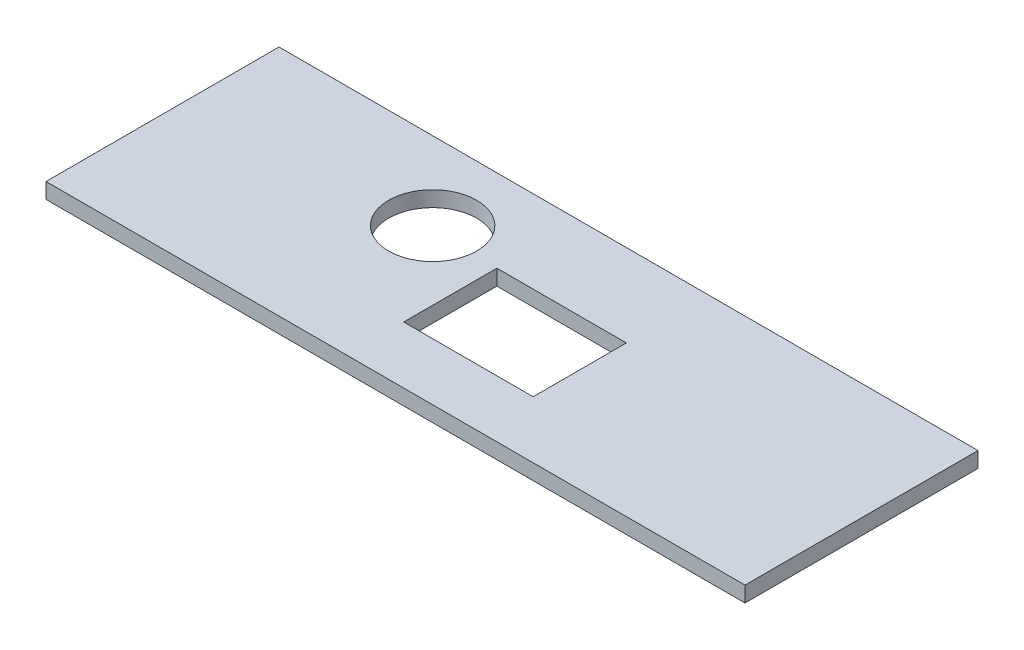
SolidWorks part; units mm, degrees
ref_plane "Front Plane" through (0, 0, 0) normal (0, 0, 1) x (1, 0, 0)
ref_plane "Top Plane" through (0, 0, 0) normal (0, 1, 0) x (1, 0, 0)
ref_plane "Right Plane" through (0, 0, 0) normal (1, 0, 0) x (0, 0, -1)
sketch "Sketch1" plane through (0, 0, 0) normal (0, 1, 0) x (1, 0, 0)
  line L1 (-67.5, -22.5) -> (67.5, -22.5)
  line L2 (-67.5, -22.5) -> (-67.5, 22.5)
  line L3 (-67.5, 22.5) -> (67.5, 22.5)
  line L4 (67.5, -22.5) -> (67.5, 22.5)
  line L5 (-67.5, -22.5) -> (67.5, 22.5) construction
  line L6 (-67.5, 22.5) -> (67.5, -22.5) construction
  point P0 (0, 0)
  dimension "D1" = 135
  dimension "D2" = 45
extrude "Boss-Extrude1" add sketch "Sketch1" along normal blind 3
sketch "Sketch2" plane through (0, 0, 0) normal (0, -1, 0) x (1, 0, 0)
  line L0 (67.5, -22.5) -> (-67.5, -22.5) construction
  line L1 (-9.4584, 11.4584) -> (15.5416, 11.4584)
  line L2 (-9.4584, 11.4584) -> (-9.4584, -6.5416)
  line L3 (-9.4584, -6.5416) -> (15.5416, -6.5416)
  line L4 (15.5416, 11.4584) -> (15.5416, -6.5416)
  line L5 (-9.4584, 11.4584) -> (15.5416, -6.5416) construction
  line L6 (-9.4584, -6.5416) -> (15.5416, 11.4584) construction
  line L7 (67.5, 22.5) -> (67.5, -22.5) construction
  point P0 (3.0416, 2.4584)
  dimension "D1" = 25
  dimension "D2" = 18
  dimension "D3" = 24.9584
  dimension "D4" = 64.4584
extrude "Cut-Extrude1" cut sketch "Sketch2" against normal up to next
sketch "Sketch3" plane through (0, 0, 0) normal (0, -1, 0) x (-1, 0, 0)
  line L0 (-67.5, 22.5) -> (67.5, 22.5) construction
  line L1 (67.5, 22.5) -> (67.5, -22.5) construction
  circle A0 centre (22.7794, 7.4534) radius 8.5
  dimension "D1" = 17
  dimension "D2" = 15.0466
  dimension "D3" = 44.7206
extrude "Cut-Extrude2" cut sketch "Sketch3" against normal up to next contours A0
